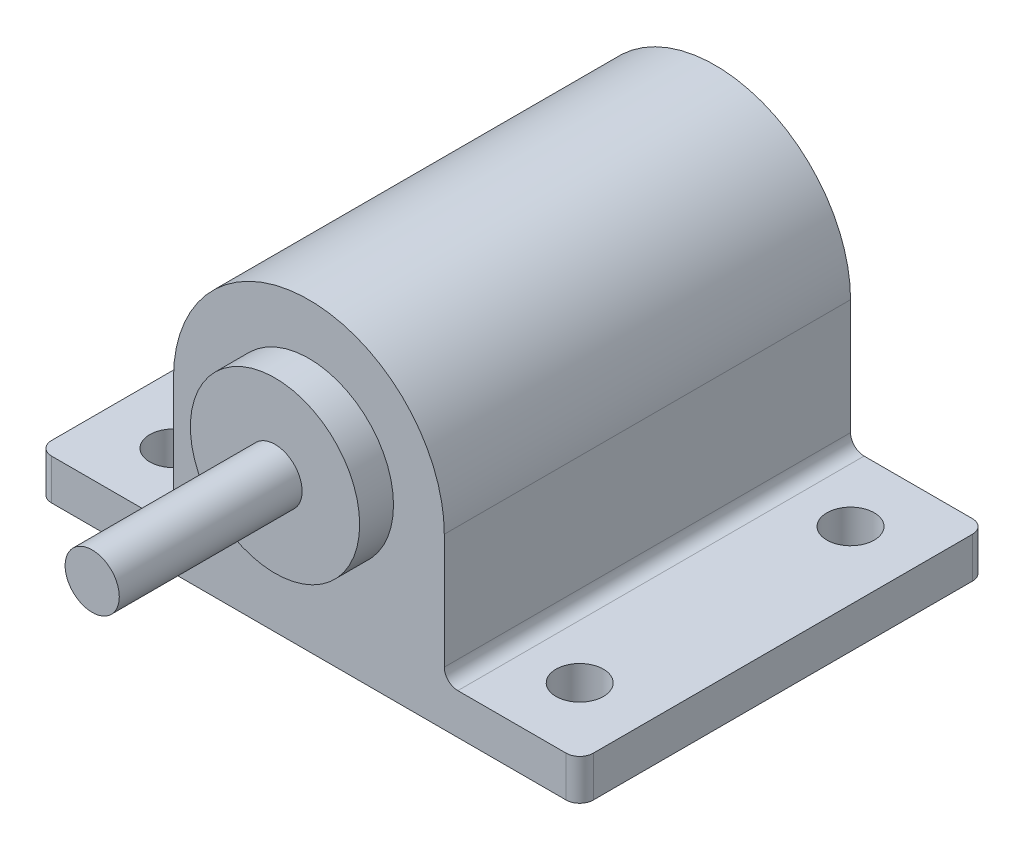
SolidWorks part; units mm, degrees
ref_plane "正面" through (0, 0, 0) normal (0, 0, 1) x (1, 0, 0)
ref_plane "平面" through (0, 0, 0) normal (0, 1, 0) x (1, 0, 0)
ref_plane "右側面" through (0, 0, 0) normal (1, 0, 0) x (0, 0, -1)
sketch "layout1" plane through (0, 0, 0) normal (0, 1, 0) x (1, 0, 0)
  line L0 (-30, 20) -> (30, -20) construction
  line L1 (-30, 20) -> (30, 20) construction
  line L2 (-30, 20) -> (-30, -20) construction
  line L3 (-30, -20) -> (30, -20) construction
  line L4 (30, 20) -> (30, -20) construction
  line L5 (30, 20) -> (-30, -20) construction
  circle A0 centre (-30, 20) radius 3.5
  circle A1 centre (30, 20) radius 3.5
  circle A2 centre (-30, -20) radius 3.5
  circle A3 centre (30, -20) radius 3.5
  point P4 (0, 0)
  dimension "D3" = 7
  dimension "D1" = 60
  dimension "D2" = 40
sketch "layout2" plane through (0, 0, 0) normal (0, 0, 1) x (1, 0, 0)
  line L0 (0, 0) -> (0, 25) construction
  circle A0 centre (0, 25) radius 20
  dimension "D2" = 40
  dimension "D1" = 25
sketch "ｽｹｯﾁ3" plane through (0, 0, 0) normal (0, 0, 1) x (1, 0, 0)
  circle A0 centre (0, 25) radius 20 construction
  circle A1 centre (0, 25) radius 20
extrude "押し出し1" add sketch "ｽｹｯﾁ3" along normal mid plane 60
sketch "ｽｹｯﾁ4" plane through (0, 0, 30) normal (0, 0, 1) x (1, 0, 0)
  circle A0 centre (0, 25) radius 12.5
  dimension "D1" = 25
extrude "押し出し2" add sketch "ｽｹｯﾁ4" along normal blind 5
sketch "ｽｹｯﾁ5" plane through (0, 0, 30) normal (0, 0, 1) x (1, 0, 0)
  circle A0 centre (0, 25) radius 4
  dimension "D1" = 8
extrude "押し出し3" add sketch "ｽｹｯﾁ5" along normal blind 32
sketch "ｽｹｯﾁ6" plane through (0, 0, 0) normal (0, 1, 0) x (1, 0, 0)
  line L0 (-30, 20) -> (-30, -20) construction
  line L1 (-40, 30) -> (40, 30)
  line L2 (-40, 30) -> (-40, -30)
  line L3 (-40, -30) -> (40, -30)
  line L4 (40, 30) -> (40, -30)
  line L5 (30, 20) -> (30, -20) construction
  line L6 (20, 30) -> (-20, 30) construction
  line L7 (-20, -30) -> (20, -30) construction
  dimension "D1" = 10
  dimension "D2" = 10
extrude "押し出し4" add sketch "ｽｹｯﾁ6" along normal blind 6
sketch "ｽｹｯﾁ7" plane through (0, 0, 0) normal (0, 1, 0) x (1, 0, 0)
  line L1 (-20, 30) -> (20, 30)
  line L2 (-20, 30) -> (-20, -30)
  line L3 (-20, -30) -> (20, -30)
  line L4 (20, 30) -> (20, -30)
extrude "押し出し5" add sketch "ｽｹｯﾁ7" along normal up to surface (25 mm away)
sketch "ｽｹｯﾁ8" plane through (0, 0, 0) normal (0, 1, 0) x (1, 0, 0)
  circle A0 centre (-30, -20) radius 3.5 construction
  circle A1 centre (30, -20) radius 3.5 construction
  circle A2 centre (30, 20) radius 3.5 construction
  circle A3 centre (-30, 20) radius 3.5 construction
  circle A4 centre (-30, -20) radius 3.5
  circle A5 centre (30, -20) radius 3.5
  circle A6 centre (30, 20) radius 3.5
  circle A7 centre (-30, 20) radius 3.5
extrude "ｶｯﾄ - 押し出し1" cut sketch "ｽｹｯﾁ8" along normal through all
fillet "ﾌｨﾚｯﾄ1" radius 2 2 edges at (-20, 6, 0) (20, 6, 0)
fillet "ﾌｨﾚｯﾄ2" radius 2 4 edges at (-40, 3, -30) (-40, 3, 30) (40, 3, -30) (40, 3, 30)
